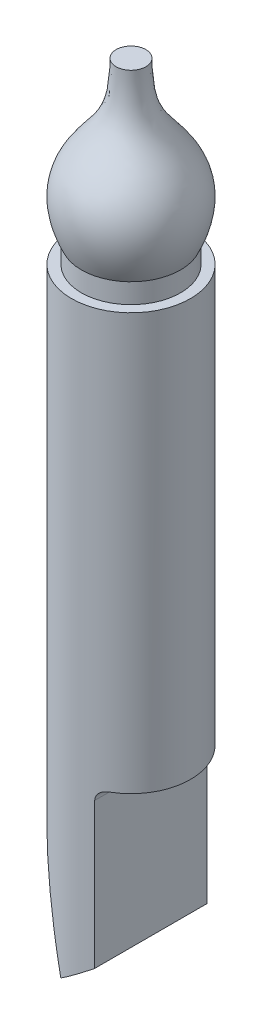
SolidWorks part; units mm, degrees
ref_plane "Спереди" through (0, 0, 0) normal (0, 0, 1) x (1, 0, 0)
ref_plane "Сверху" through (0, 0, 0) normal (0, 1, 0) x (1, 0, 0)
ref_plane "Справа" through (0, 0, 0) normal (1, 0, 0) x (0, 0, -1)
sketch "Эскиз1" plane through (0, 0, 0) normal (0, 0, 1) x (1, 0, 0)
  line L0 (0, 0) -> (3, 0)
  line L1 (3, 0) -> (3, 30)
  line L2 (3, 30) -> (2.5, 30)
  line L3 (0, 39) -> (0, 0)
  line L4 (2.5, 30) -> (2.5, 31)
  line L5 (0.75, 39) -> (0, 39)
  line L6 (0.75, 36.8304) -> (0.75, 39.5097) construction
  spline S0 degree 3 poles (0.75, 39) (0.75, 36.9949) (1.623, 35.8717) (3.6222, 33.3621) (2.5, 31) knots 0 0 0 0 0.491714 1 1 1 1
  dimension "D1" = 3
  dimension "D2" = 30
  dimension "D3" = 0.75
  dimension "D4" = 9
  dimension "D5" = 1
  dimension "D6" = 0.5
revolve "Повернуть1" add sketch "Эскиз1" angle 360 about L3
sketch "Эскиз2" plane through (0, 0, 0) normal (0, 0, 1) x (1, 0, 0)
  line L0 (-0.6, 5.3388) -> (-0.6, -2.919) construction
  line L1 (-0.6, 0) -> (-3, 8.9569)
  line L2 (-3, 0) -> (3, 0) construction
  line L3 (-0.6, 0) -> (1, 1.1625)
  line L4 (-3, 30) -> (-3, 0) construction
  line L5 (1, 1.1625) -> (1, 8.5)
  line L6 (1.5, 9) -> (3, 9)
  line L7 (3, 0) -> (3, 30) construction
  line L8 (-3, 8.9569) -> (-4.6316, 8.9569)
  line L9 (-4.6316, 8.9569) -> (-4.6316, -0.8212)
  line L10 (-4.6316, -0.8212) -> (4.4553, -0.8212)
  line L11 (4.4553, -0.8212) -> (4.4553, 9)
  line L12 (4.4553, 9) -> (3, 9)
  arc A0 (1, 8.5) -> (1.5, 9) centre (1.5, 8.5) cw
  dimension "D6" = 0.5
  dimension "D1" = 0.6
  dimension "D2" = 15
  dimension "D3" = 54
  dimension "D4" = 1
  dimension "D5" = 9
extrude "Вырез-Вытянуть1" cut sketch "Эскиз2" against normal through all and the other way through all contours L3 L0 L10 L11 L12 L6 A0 L5 | L0 L1 L8 L9 L10
